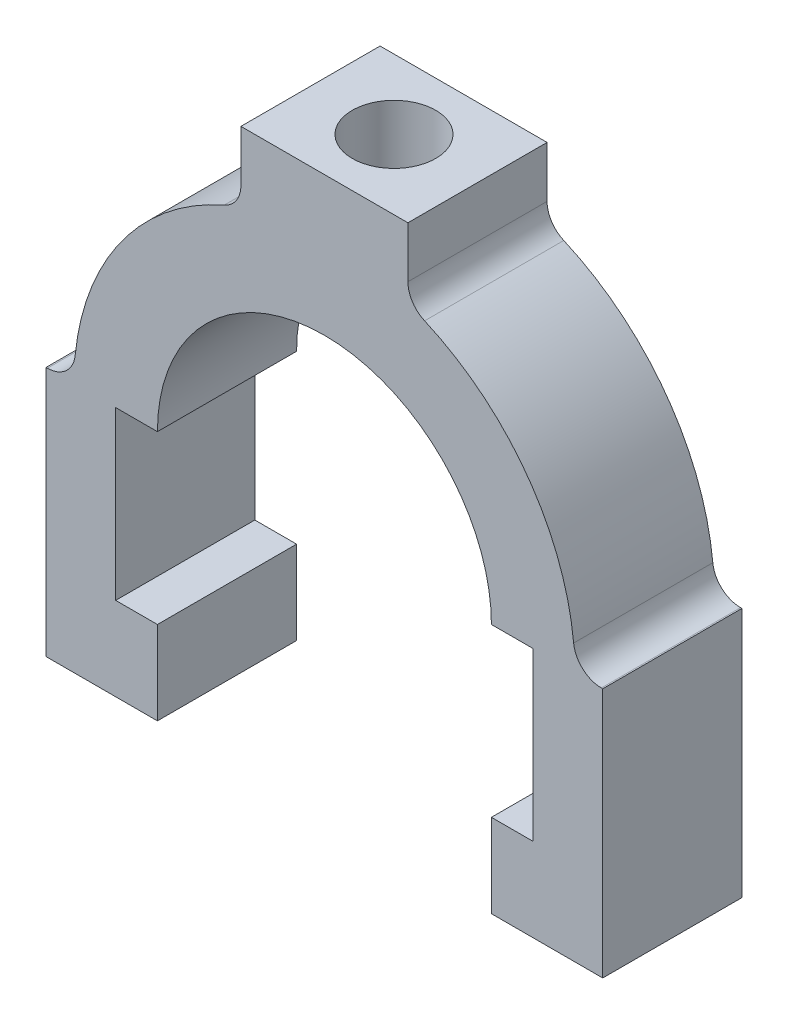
SolidWorks part; units mm, degrees
ref_plane "Front Plane" through (0, 0, 0) normal (0, 0, 1) x (1, 0, 0)
ref_plane "Top Plane" through (0, 0, 0) normal (0, 1, 0) x (1, 0, 0)
ref_plane "Right Plane" through (0, 0, 0) normal (1, 0, 0) x (0, 0, -1)
sketch "Sketch2" plane through (0, 0, 0) normal (0, 0, 1) x (1, 0, 0)
  line L0 (0, 0) -> (0, -30197.1925) construction
  line L1 (0, 0) -> (12, 0)
  line L2 (12, 0) -> (12, -7.3394)
  line L3 (0, 0) -> (0, -80) construction
  line L4 (0, -44) -> (80, -44) construction
  line L6 (40, -80) -> (24, -80)
  line L7 (24, -80) -> (24, -68)
  line L8 (24, -68) -> (30, -68)
  line L9 (30, -68) -> (30, -44)
  line L10 (30, -44) -> (24, -44)
  line L11 (0, -20) -> (0, 0)
  line L12 (40, -80) -> (40, -44)
  line L13 (40, -44) -> (39.7995, -44)
  arc A0 (14.4, -11.0055) -> (35.8195, -40.4) centre (0, -44) cw
  arc A1 (0, -20) -> (24, -44) centre (0, -44) cw
  arc A2 (12, -7.3394) -> (14.4, -11.0055) centre (16, -7.3394) ccw
  arc A3 (35.8195, -40.4) -> (39.7995, -44) centre (39.7995, -40) ccw
  point P22 (36, -44)
  dimension "D4" = 36
  dimension "D5" = 24
  dimension "D9" = 4
  dimension "D12" = 4
  dimension "D1" = 12
  dimension "D2" = 80
  dimension "D3" = 36
  dimension "D6" = 6
  dimension "D7" = 12
  dimension "D8" = 6
  dimension "D10" = 16
  dimension "D11" = 4
extrude "Boss-Extrude1" add sketch "Sketch2" along normal blind 20
mirror "Mirror1" about plane through (0, -20, 20) normal (1, 0, 0) of "Boss-Extrude1"
sketch "Sketch3" plane through (0, 0, 0) normal (0, 1, 0) x (1, 0, 0)
  line L0 (12, -20) -> (12, 0) construction
  line L1 (12, 0) -> (-12, 0) construction
  circle A0 centre (0, -10) radius 6
  dimension "D1" = 12
  dimension "D2" = 12
  dimension "D3" = 10
extrude "Cut-Extrude1" cut sketch "Sketch3" against normal blind 38
